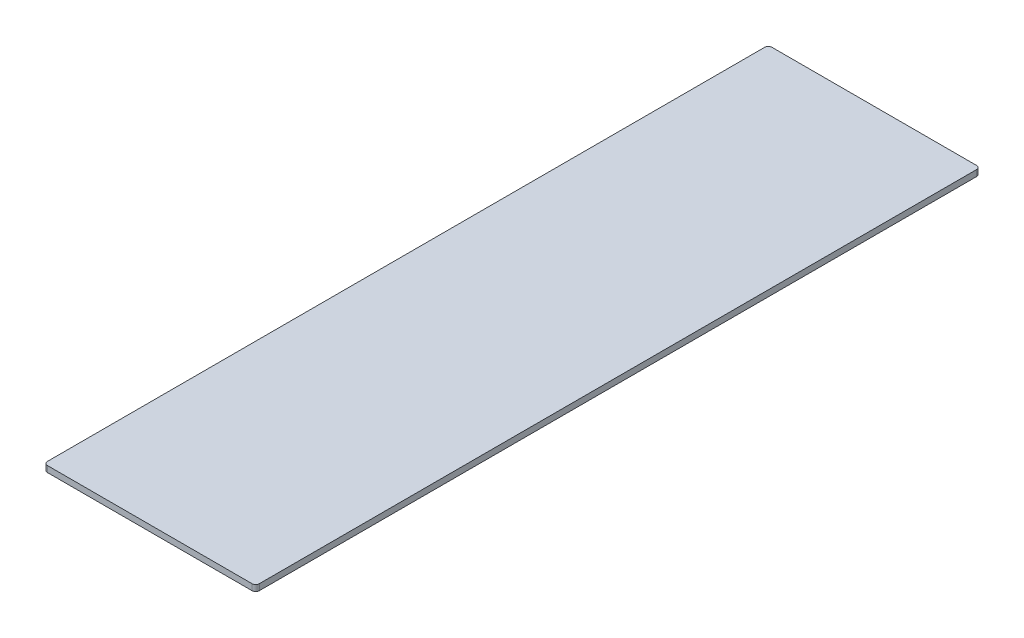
SolidWorks part; units mm, degrees
ref_plane "Piano frontale" through (0, 0, 0) normal (0, 0, 1) x (1, 0, 0)
ref_plane "Piano superiore" through (0, 0, 0) normal (0, 1, 0) x (1, 0, 0)
ref_plane "Piano destro" through (0, 0, 0) normal (1, 0, 0) x (0, 0, -1)
sketch "Schizzo1" plane through (0, 0, 0) normal (0, 1, 0) x (1, 0, 0)
  line L1 (86.7, -296.5) -> (-86.7, -296.5)
  line L2 (86.7, -296.5) -> (86.7, 296.5)
  line L3 (86.7, 296.5) -> (-86.7, 296.5)
  line L4 (-86.7, -296.5) -> (-86.7, 296.5)
  line L5 (86.7, -296.5) -> (-86.7, 296.5) construction
  line L6 (86.7, 296.5) -> (-86.7, -296.5) construction
  point P0 (0, 0)
  dimension "D1" = 173.4
  dimension "D2" = 593
base flange "Base-Flangia1" sketch "Schizzo1" thickness 5 reverse thickness direction no parameters "D1"=3.3
fillet "Raccordo1" radius 3 4 edges at (86.7, -2.5, -296.5) (-86.7, -2.5, -296.5) (-86.7, -2.5, 296.5) (86.7, -2.5, 296.5)
sketch "Linee di piegatura1" [suppressed] plane through (0, 0, 0) normal (0, 1, 0) x (1, 0, 0)
sketch "Casella di contorno1" [suppressed] plane through (0, 0, 0) normal (0, 1, 0) x (1, 0, 0)
sheet metal parameters "Lamiera3" thickness 5 parameters "D1"=1.7
flat pattern "Ripetizione piatta3"
sketch "Linee di piegatura2" plane through (0, 0, 0) normal (0, 1, 0) x (1, 0, 0)
sketch3d "Casella di contorno2" [suppressed]
  line L0 (86.7, 296.5, 0) -> (86.7, -296.5, 0) construction
  line L1 (-86.7, 296.5, 0) -> (-86.7, -296.5, 0) construction
  line L2 (86.7, 296.5, 0) -> (-86.7, 296.5, 0) construction
  line L3 (86.7, -296.5, 0) -> (-86.7, -296.5, 0) construction
equation "\"Lam_vern\"= 2 * ( \"SW-Massa\" / \"SW-Densità\" ) / ( \"Spessore\" / 1000 )"
